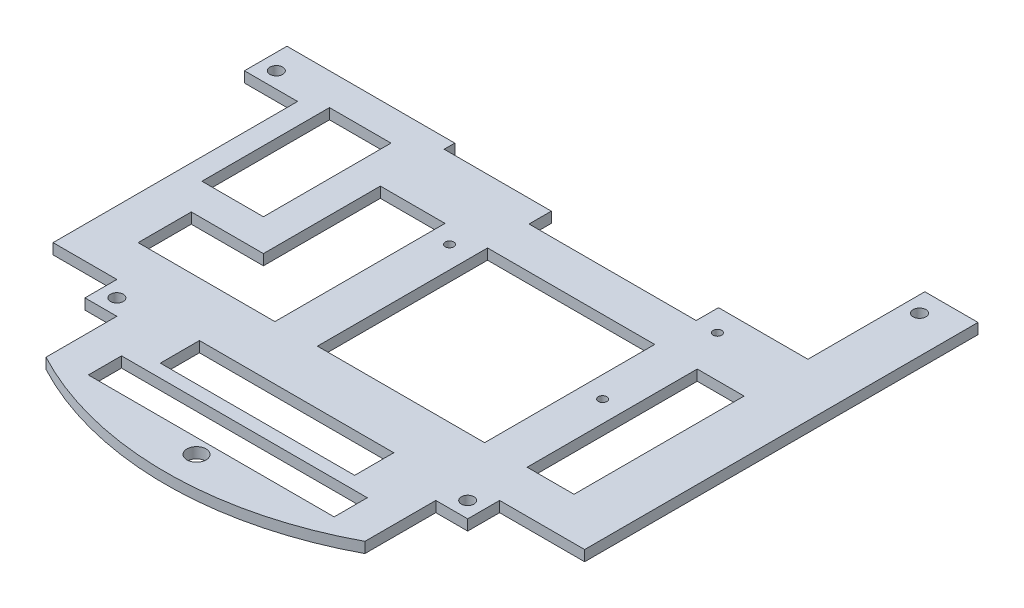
SolidWorks part; units mm, degrees
ref_plane "Ebene vorne" through (0, 0, 0) normal (0, 0, 1) x (1, 0, 0)
ref_plane "Ebene oben" through (0, 0, 0) normal (0, 1, 0) x (1, 0, 0)
ref_plane "Ebene rechts" through (0, 0, 0) normal (1, 0, 0) x (0, 0, -1)
sketch "Skizze1" plane through (0, 0, 0) normal (0, 1, 0) x (1, 0, 0)
  line L0 (45.7, -116.363) -> (45.7, -97.963) construction
  line L1 (45.7, -97.963) -> (-45.7, -97.963) construction
  line L2 (-45.7, -116.363) -> (45.7, -116.363) construction
  line L3 (-45.7, -97.963) -> (-45.7, -116.363) construction
  line L4 (45.7, -116.363) -> (45.7, -97.963)
  line L5 (45.7, -97.963) -> (-45.7, -97.963)
  line L6 (-45.7, -116.363) -> (45.7, -116.363)
  line L7 (-45.7, -97.963) -> (-45.7, -116.363)
  line L8 (57.8, -122.5106) -> (-57.8, -122.5106) construction
  line L9 (-57.8, -122.5106) -> (-57.8, -138.1106) construction
  line L10 (-57.8, -138.1106) -> (57.8, -138.1106) construction
  line L11 (57.8, -138.1106) -> (57.8, -122.5106) construction
  line L12 (57.8, -122.5106) -> (-57.8, -122.5106)
  line L13 (-57.8, -122.5106) -> (-57.8, -138.1106)
  line L14 (-57.8, -138.1106) -> (57.8, -138.1106)
  line L15 (57.8, -138.1106) -> (57.8, -122.5106)
  line L16 (-14.4795, 7.5) -> (-100, 7.5) construction
  line L17 (-100, 7.5) -> (-100, -72.5) construction
  line L18 (-100, -72.5) -> (-14.4795, -72.5) construction
  line L19 (-15.6665, 37.5) -> (-66.0703, 37.5)
  line L20 (105, 7.5) -> (82.9546, 7.5)
  line L21 (-100, -47.5) -> (-100, -72.5)
  line L22 (-100, -72.5) -> (-35.6665, -72.5)
  line L23 (105, -72.5) -> (105, 7.5)
  line L24 (-100, -47.5) -> (-66.0703, -47.5)
  line L25 (125.25, 92.5) -> (-125.25, 92.5) construction
  line L26 (-110, 27.5) -> (-81.0703, 27.5)
  line L27 (-110, 27.5) -> (-110, -32.5)
  line L28 (-110, -32.5) -> (-81.0703, -32.5)
  line L29 (-81.0703, 27.5) -> (-81.0703, -32.5)
  line L30 (-66.0703, -47.5) -> (-66.0703, 7.5)
  line L31 (-130, 92.5) -> (-130, 37.5)
  line L32 (-130, 37.5) -> (-145, 37.5)
  line L33 (-145, 37.5) -> (-145, 22.5)
  line L34 (-145, 22.5) -> (-156.0879, 15)
  line L35 (-120, 22.5) -> (-145, 22.5)
  line L36 (155, -15) -> (155, 15)
  line L37 (-156.0879, 15) -> (-156.0879, -15)
  line L38 (-156.0879, -15) -> (-130, -15)
  line L39 (-130, -15) -> (-130, -92.5)
  line L40 (-130, -92.5) -> (-90, -92.5)
  line L41 (-90, -92.5) -> (-90, -107.5)
  line L42 (-90, -107.5) -> (-75, -107.5)
  line L43 (-75, -107.5) -> (-75, -140.8235)
  line L44 (75, -140.8235) -> (75, -107.5)
  line L45 (75, -107.5) -> (90, -107.5)
  line L46 (90, -107.5) -> (90, -92.5)
  line L47 (90, -92.5) -> (130, -92.5)
  line L48 (130, -92.5) -> (130, -15)
  line L49 (130, -15) -> (155, -15)
  line L51 (155, 15) -> (130, 15)
  line L52 (130, 15) -> (130, 92.5)
  line L53 (62.9546, 7.5) -> (-15.6665, 7.5)
  line L54 (130, 92.5) -> (105, 92.5) construction
  line L55 (130, 92.5) -> (105, 92.5)
  line L56 (105, 92.5) -> (105, 37.5) construction
  line L57 (130, 92.5) -> (105, 92.5)
  line L58 (105, 92.5) -> (105, 37.5)
  line L59 (105, 37.5) -> (-110, 37.5)
  line L60 (-110, 37.5) -> (-110, 92.5)
  line L61 (-110, 92.5) -> (-130, 92.5)
  line L62 (-120, -27.5) -> (-120, 22.5)
  line L63 (105, 92.5) -> (105, 37.5)
  line L64 (-145, 37.5) -> (-145, 22.5)
  line L65 (-15.6665, 37.5) -> (-15.6665, 27)
  line L66 (82.9546, -72.5) -> (105, -72.5)
  line L67 (62.9546, 7.5) -> (62.9546, -72.5)
  line L68 (-145, 37.5) -> (-145, 42.5)
  line L69 (-145, 42.5) -> (-66.0703, 42.5)
  line L70 (-120, -27.5) -> (-120, -92.5)
  line L71 (-120, -92.5) -> (-90, -92.5)
  line L72 (-90, -92.5) -> (-90, -107.5)
  line L73 (-90, -107.5) -> (-75, -107.5)
  line L74 (-75, -107.5) -> (-75, -140.8235)
  line L75 (75, -140.8235) -> (75, -107.5)
  line L76 (75, -107.5) -> (90, -107.5)
  line L77 (90, -107.5) -> (90, -92.5)
  line L78 (90, -92.5) -> (130, -92.5)
  line L79 (130, -92.5) -> (130, 15)
  line L80 (-66.0703, 37.5) -> (-66.0703, 42.5)
  line L81 (-15.6665, 27) -> (62.9546, 27)
  line L82 (82.9546, 7.5) -> (82.9546, -72.5)
  line L83 (130, 15) -> (130, 92.5)
  line L84 (62.9546, 37.5) -> (62.9546, 27)
  line L90 (105, 37.5) -> (62.9546, 37.5)
  line L165 (-35.6665, 7.5) -> (-66.0703, 7.5)
  line L166 (-15.6665, -72.5) -> (62.9546, -72.5)
  line L167 (-35.6665, 7.5) -> (-35.6665, -72.5)
  line L169 (-15.6665, 7.5) -> (-15.6665, -72.5)
  circle A0 centre (-137.5, 30) radius 3 construction
  arc A1 (-75, -140.8235) -> (75, -140.8235) centre (0, 0) ccw
  arc A2 (-75, -140.8235) -> (75, -140.8235) centre (0, 0) ccw
  circle A4 centre (82.5, -100) radius 3 construction
  circle A5 centre (-82.5, -100) radius 3 construction
  circle A6 centre (-137.5, 30) radius 3
  circle A8 centre (82.5, -100) radius 3
  circle A9 centre (-82.5, -100) radius 3
  circle A10 centre (112.5, 82.5) radius 3 construction
  circle A11 centre (0, -145.027) radius 4.5
  circle A12 centre (112.5, 82.5) radius 3
  circle A14 centre (-26.0438, 0) radius 3 construction
  circle A15 centre (-26.0438, 0) radius 3 construction
  circle A16 centre (72.9562, -27) radius 3 construction
  circle A17 centre (72.9562, 27) radius 3 construction
  circle A18 centre (72.9562, -27) radius 3 construction
  circle A19 centre (72.9562, 27) radius 3 construction
  circle A20 centre (-26.0438, 0) radius 2
  circle A21 centre (72.9562, -27) radius 2
  circle A22 centre (72.9562, 27) radius 2
  dimension "D9" = 9
  dimension "D1" = 0
  dimension "D2" = 65
  dimension "D3" = 125
  dimension "D4" = 15
  dimension "D5" = 10
  dimension "D6" = 15
  dimension "D7" = 15
  dimension "D8" = 20
  dimension "D10" = 20
  dimension "D11" = 20
  dimension "D12" = 1
extrude "Aufsatz-Linear austragen1" add sketch "Skizze1" along normal blind 5
